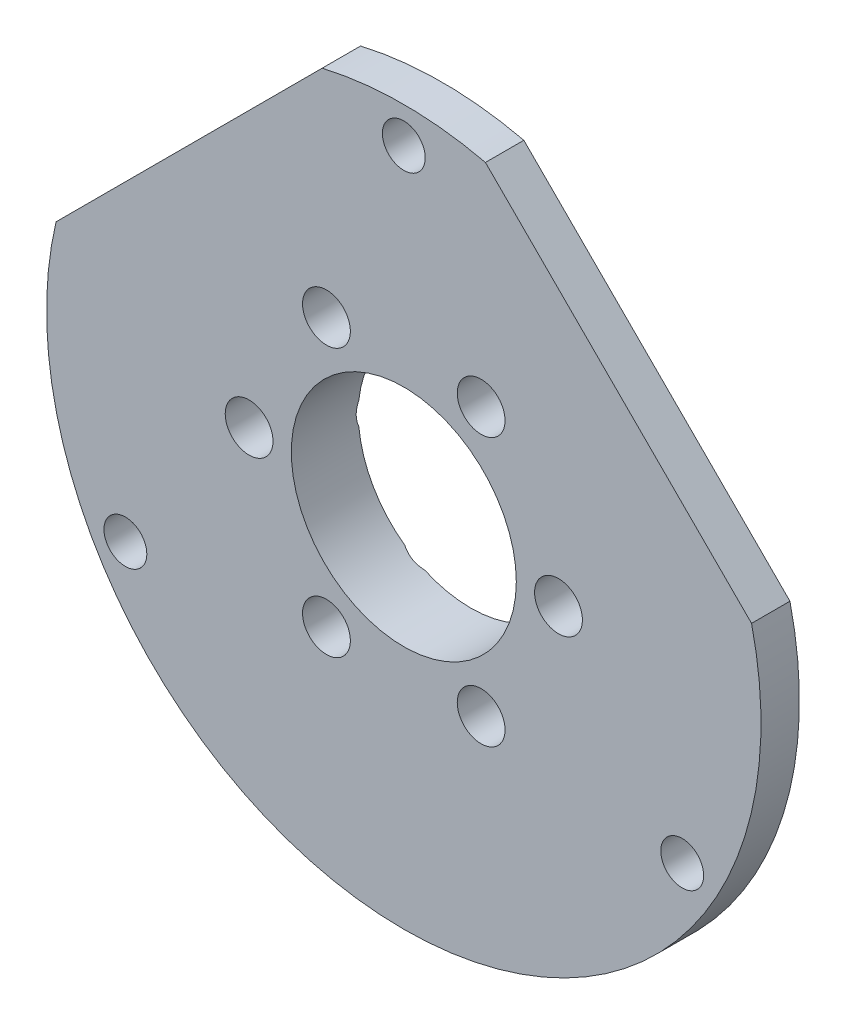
SolidWorks part; units mm, degrees
ref_plane "Front Plane" through (0, 0, 0) normal (0, 0, 1) x (1, 0, 0)
ref_plane "Top Plane" through (0, 0, 0) normal (0, 1, 0) x (1, 0, 0)
ref_plane "Right Plane" through (0, 0, 0) normal (1, 0, 0) x (0, 0, -1)
sketch "Sketch1" plane through (0, 0, 0) normal (0, 0, 1) x (1, 0, 0)
  circle A0 centre (0, 0) radius 25.4
  dimension "D1" = 50.8
extrude "base_2od" add sketch "Sketch1" along normal blind 4.7625
sketch "Sketch3" plane through (0, 0, 4.7625) normal (0, 0, 1) x (1, 0, 0)
  circle A1 centre (0, 0) radius 22.86 construction
  circle A2 centre (19.7973, -11.43) radius 1.524
  circle A3 centre (-19.7973, -11.43) radius 1.524
  circle A4 centre (0, 22.86) radius 1.524
  dimension "D1" = 3.048
  dimension "D2" = 45.72
extrude "to_flange_bcd" cut sketch "Sketch3" against normal through all
sketch "Sketch2" plane through (0, 0, 4.7625) normal (0, 0, 1) x (1, 0, 0)
  circle A0 centre (0, 0) radius 8
  dimension "D1" = 16
extrude "center_thru_hole" cut sketch "Sketch2" against normal through all
sketch "Sketch4" plane through (0, 0, 0) normal (0, 0, -1) x (-1, 0, 0)
  line L0 (0, 0) -> (11, 0) construction
  circle A0 centre (11, 0) radius 1.5
  circle A1 centre (5.5, -9.5263) radius 1.5
  circle A2 centre (-5.5, -9.5263) radius 1.5
  circle A3 centre (-11, 0) radius 1.5
  circle A4 centre (-5.5, 9.5263) radius 1.5
  circle A5 centre (5.5, 9.5263) radius 1.5
  dimension "D2" = 3
  dimension "D1" = 11
hole_wizard "motor_bcd" positions "3DSketch2" profile "Sketch7" countersink size "M3" standard "Ansi Metric"
sketch3d "3DSketch2"
  point P0 (-11, 0, 0)
  point P2 (-5.5, 9.5263, 0)
  point P4 (5.5, 9.5263, 0)
  point P6 (11, 0, 0)
  point P8 (5.5, -9.5263, 0)
  point P10 (-5.5, -9.5263, 0)
sketch "Sketch7" plane through (-11, 0, 0) normal (1, 0, 0) x (0, 1, 0)
  line L0 (0, 0) -> (0, 4.7625)
  line L1 (0, 4.7625) -> (1.7, 4.7625)
  line L2 (1.7, 4.7625) -> (1.7, 1.45)
  line L3 (1.7, 1.45) -> (3.15, 0)
  line L5 (3.15, 0) -> (0, 0)
  line L6 (-1.7, 1.45) -> (-3.15, 0) construction
  line L11 (0, -6.35) -> (0, 107.95) construction
  dimension "Thru Hole Dia." = 3.4
  dimension "Thru Hole Depth" = 4.7625
  dimension "Near C'Sink Dia." = 6.3
  dimension "Near C'Sink Angle" = 90
sketch "Sketch8" plane through (0, 0, 0) normal (0, 0, -1) x (-1, 0, 0)
  circle A0 centre (0, 0) radius 18.415
  dimension "D1" = 36.83
extrude "lip" cut sketch "Sketch8" against normal blind 2.032 flip side to cut
sketch "Sketch9" plane through (0, 0, 4.7625) normal (0, 0, 1) x (1, 0, 0)
  line L0 (0, 0) -> (15.2664, 15.2664) construction
  line L1 (0, 0) -> (25.4, 0) construction
  line L2 (3.6108, 26.9221) -> (26.9221, 3.6108)
  line L3 (3.6108, 26.9221) -> (6.7489, 30.0603)
  line L4 (6.7489, 30.0603) -> (30.0603, 6.7489)
  line L5 (30.0603, 6.7489) -> (26.9221, 3.6108)
  line L6 (0, 0) -> (0, 28.47) construction
  line L7 (-3.6108, 26.9221) -> (-26.9221, 3.6108)
  line L8 (-30.0603, 6.7489) -> (-26.9221, 3.6108)
  line L9 (-6.7489, 30.0603) -> (-30.0603, 6.7489)
  line L10 (-3.6108, 26.9221) -> (-6.7489, 30.0603)
  circle A0 centre (0, 0) radius 25.4 construction
  dimension "D1" = 45
  dimension "D2" = 21.59
extrude "45_DEG_CUT" cut sketch "Sketch9" against normal through all
chamfer "Chamfer1" distance 0.508 angle 45 1 edges at (-18.415, 0, 0)
